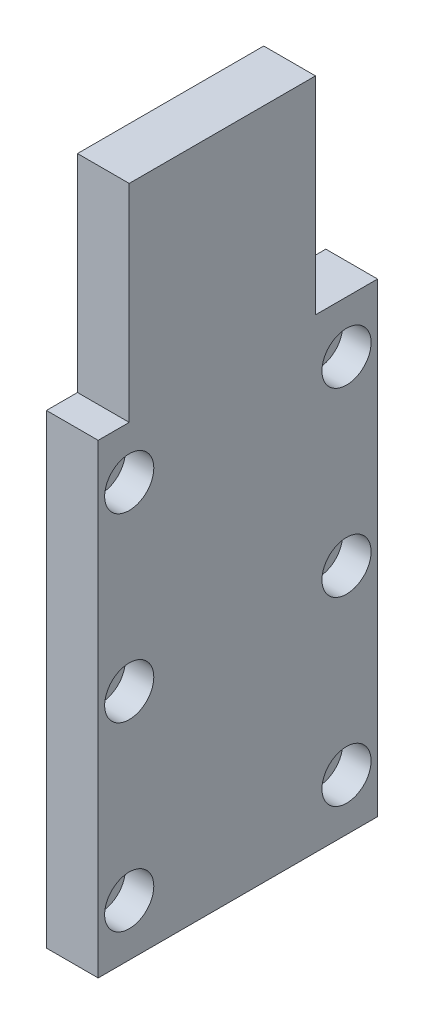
SolidWorks part; units mm, degrees
ref_plane "前视基准面" through (0, 0, 0) normal (0, 0, 1) x (1, 0, 0)
ref_plane "上视基准面" through (0, 0, 0) normal (0, 1, 0) x (1, 0, 0)
ref_plane "右视基准面" through (0, 0, 0) normal (1, 0, 0) x (0, 0, -1)
sketch "草图1" plane through (0, 0, 0) normal (0, 0, 1) x (1, 0, 0)
  line L0 (0, 0) -> (0, 130)
  line L1 (10, 0) -> (10, 130)
  line L2 (0, 0) -> (10, 0)
  line L3 (0, 130) -> (10, 130)
extrude "凸台-拉伸1" add sketch "草图1" along normal blind 54
sketch "草图2" plane through (10, 0, 0) normal (1, 0, 0) x (0, 0, -1)
  line L0 (-48, 130) -> (-12, 130)
  line L1 (-54, 0) -> (0, 0)
  line L2 (-54, 0) -> (-54, 90)
  line L3 (0, 0) -> (0, 90)
  line L4 (-54, 90) -> (-48, 90)
  line L5 (-48, 90) -> (-48, 130)
  line L6 (-12, 90) -> (-12, 130)
  line L7 (-12, 90) -> (0, 90)
  circle A0 centre (-48, 80) radius 2.75
  circle A1 centre (-6, 80) radius 2.75
  circle A2 centre (-48, 45) radius 2.75
  circle A3 centre (-6, 45) radius 2.75
  circle A4 centre (-6, 10) radius 2.75
  circle A5 centre (-48, 10) radius 2.75
extrude "切除-拉伸1" cut sketch "草图2" against normal blind 54 flip side to cut
sketch "草图3" plane through (10, 0, 0) normal (1, 0, 0) x (0, 0, -1)
  circle A0 centre (-48, 80) radius 4.75
  circle A1 centre (-6, 80) radius 4.75
  circle A2 centre (-48, 45) radius 4.75
  circle A3 centre (-6, 45) radius 4.75
  circle A4 centre (-6, 10) radius 4.75
  circle A5 centre (-48, 10) radius 4.75
extrude "切除-拉伸2" cut sketch "草图3" against normal blind 5.5
